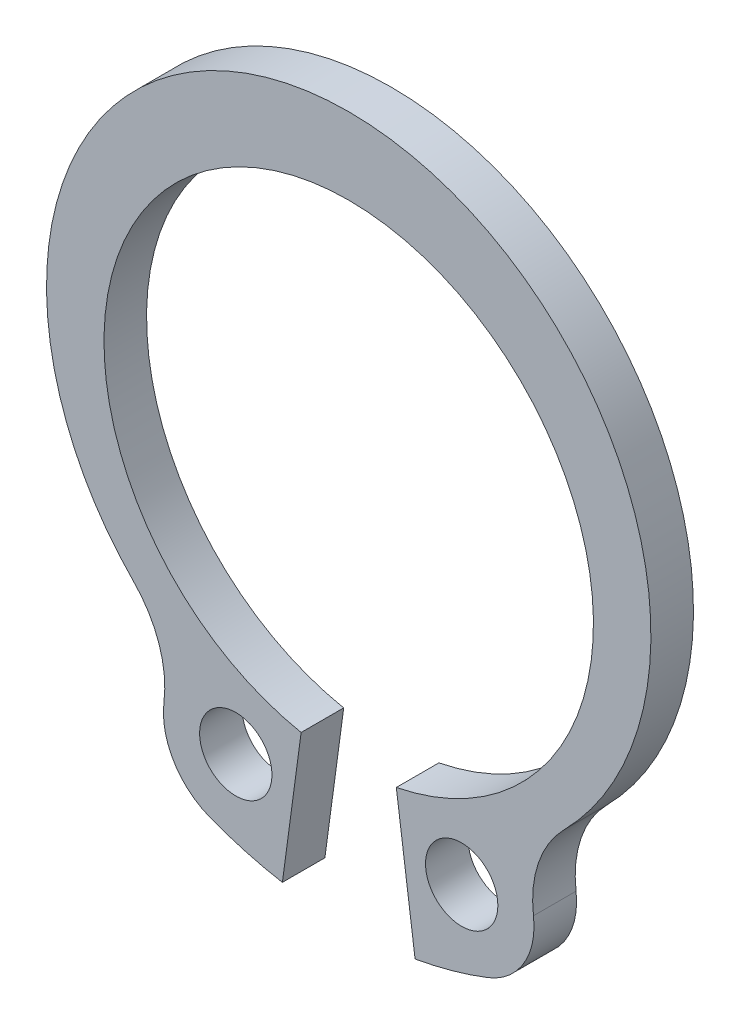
SolidWorks part; units mm, degrees
ref_plane "Face" through (0, 0, 0) normal (0, 0, 1) x (1, 0, 0)
ref_plane "Dessus" through (0, 0, 0) normal (0, 1, 0) x (1, 0, 0)
ref_plane "Droite" through (0, 0, 0) normal (1, 0, 0) x (0, 0, -1)
sketch "Esquisse1" plane through (0, 0, 0) normal (0, 0, 1) x (1, 0, 0)
  line L0 (0, 7.55) -> (0, 5.75) construction
  line L1 (1.1184, -5.6402) -> (1.559, -8.9106)
  line L2 (-1.1184, -5.6402) -> (-1.559, -8.9106)
  line L3 (0.34, -5.4895) -> (0.34, -8.7895) construction
  line L4 (-0.34, -5.4895) -> (-0.34, -8.7895) construction
  arc A0 (1.1184, -5.6402) -> (-1.1184, -5.6402) centre (0, 0) ccw
  arc A1 (5.0555, -4.5352) -> (-5.0555, -4.5352) centre (0, 0.45) ccw
  arc A2 (1.559, -8.9106) -> (3.2678, -8.4351) centre (0, 0) ccw
  circle A3 centre (2.6537, -6.8499) radius 0.85
  arc A4 (3.2678, -8.4351) -> (4.3407, -6.6402) centre (2.6537, -6.8499) ccw
  arc A5 (5.0555, -4.5352) -> (4.3407, -6.6402) centre (6.8712, -6.3256) ccw
  circle A6 centre (-2.6537, -6.8499) radius 0.85
  arc A7 (-5.0555, -4.5352) -> (-4.3407, -6.6402) centre (-6.8712, -6.3256) cw
  arc A8 (-3.2678, -8.4351) -> (-4.3407, -6.6402) centre (-2.6537, -6.8499) cw
  arc A9 (-1.559, -8.9106) -> (-3.2678, -8.4351) centre (0, 0) cw
  arc A10 (0.34, -5.4895) -> (-0.34, -5.4895) centre (0, 0) ccw construction
  circle A11 centre (0, 0) radius 6 construction
  dimension "dgorge" = 11.5
  dimension "D3" = 0.45
  dimension "dtrou" = 1.7
  dimension "D8" = 1.7
  dimension "D9" = 2.55
  dimension "dint" = 11
  dimension "dn" = 12
  dimension "b" = 1.8
  dimension "a" = 3.3
  dimension "D5" = 22.432
  dimension "D7" = 1.36
  dimension "D12" = 0.68
  dimension "D13" = 7.088
  dimension "D14" = 7.672
extrude "Base-Extrusion" add sketch "Esquisse1" along normal blind 1
equation "\"D3@Esquisse1\" = \"b@Esquisse1\"/4"
equation "\"D7@Esquisse1\"=\"dtrou@Esquisse1\"*0.8"
equation "\"D8@Esquisse1\" = \"dtrou@Esquisse1\""
equation "\"D9@Esquisse1\" = \"dtrou@Esquisse1\"*1.5"
equation "\"D12@Esquisse1\" = \"dtrou@Esquisse1\"*0.4"
equation "\"D5@Esquisse1\" = 360-(360-\"D13@Esquisse1\")*\"dint@Esquisse1\"/\"dgorge@Esquisse1\""
equation "\"D14@Esquisse1\" = (\"D5@Esquisse1\"-\"D13@Esquisse1\")/2"
